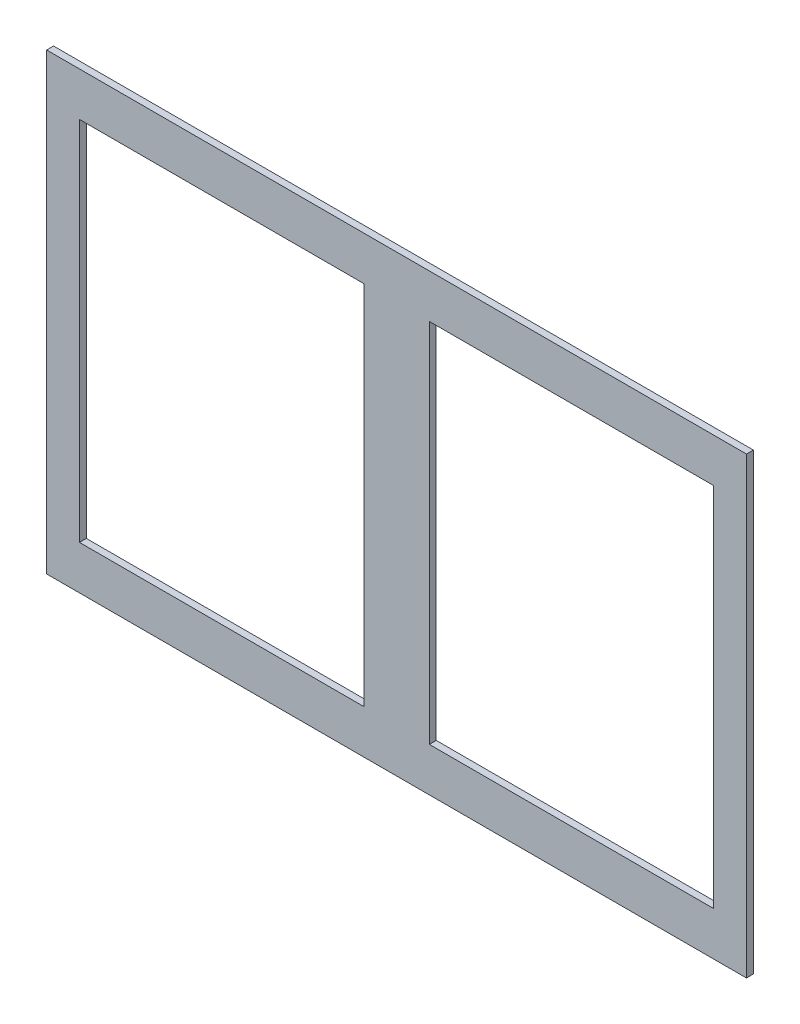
SolidWorks part; units mm, degrees
ref_plane "Front Plane" through (0, 0, 0) normal (0, 0, 1) x (1, 0, 0)
ref_plane "Top Plane" through (0, 0, 0) normal (0, 1, 0) x (1, 0, 0)
ref_plane "Right Plane" through (0, 0, 0) normal (1, 0, 0) x (0, 0, -1)
sketch "Sketch1" plane through (0, 0, 0) normal (0, 0, 1) x (1, 0, 0)
  line L0 (-330.2, 0) -> (-406.4, 0) construction
  line L1 (-330.2, 425.45) -> (330.2, 425.45)
  line L2 (-330.2, 425.45) -> (-330.2, -425.45)
  line L3 (-330.2, -425.45) -> (330.2, -425.45)
  line L4 (330.2, 425.45) -> (330.2, -425.45)
  line L5 (-330.2, 425.45) -> (330.2, -425.45) construction
  line L6 (-330.2, -425.45) -> (330.2, 425.45) construction
  line L7 (-406.4, 527.05) -> (1219.2, 527.05)
  line L8 (-406.4, 527.05) -> (-406.4, -527.05)
  line L9 (-406.4, -527.05) -> (1219.2, -527.05)
  line L10 (406.4, 527.05) -> (406.4, -527.05)
  line L11 (-406.4, 527.05) -> (406.4, -527.05) construction
  line L12 (-406.4, -527.05) -> (406.4, 527.05) construction
  line L13 (330.2, 0) -> (406.4, 0) construction
  line L14 (0, 501.65) -> (0, 425.45) construction
  line L15 (482.6, 425.45) -> (482.6, -425.45)
  line L16 (1143, -425.45) -> (482.6, -425.45)
  line L17 (1219.2, 527.05) -> (1219.2, -527.05)
  line L18 (1143, 425.45) -> (1143, -425.45)
  line L19 (1143, 425.45) -> (482.6, 425.45)
  point P0 (0, 0)
  point P5 (0, 0)
  dimension "D1" = 660.4
  dimension "D2" = 850.9
  dimension "D3" = 76.2
  dimension "D4" = 76.2
extrude "Boss-Extrude1" add sketch "Sketch1" along normal blind 16 contours L10 L7 L8 L9 L1 L4 L3 L2 | L17 L7 L10 L9 L19 L18 L16 L15
